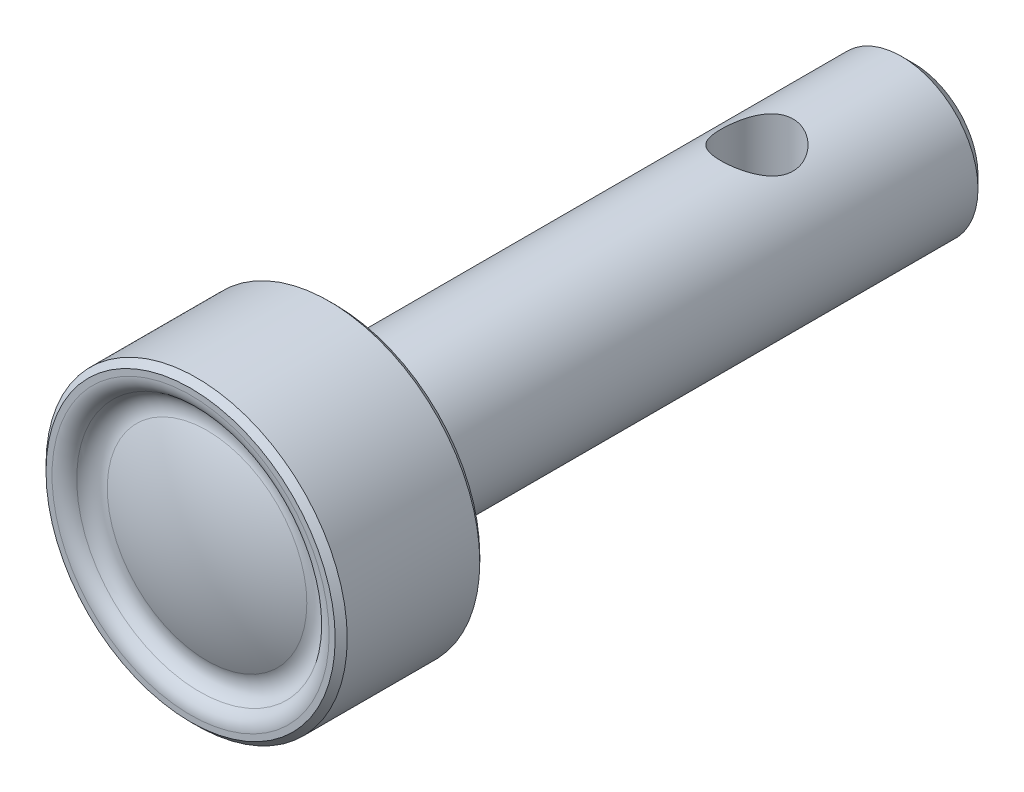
SolidWorks part; units mm, degrees
ref_plane "Спереди" through (0, 0, 0) normal (0, 0, 1) x (1, 0, 0)
ref_plane "Сверху" through (0, 0, 0) normal (0, 1, 0) x (1, 0, 0)
ref_plane "Справа" through (0, 0, 0) normal (1, 0, 0) x (0, 0, -1)
sketch "Эскиз1" plane through (0, 0, 0) normal (1, 0, 0) x (0, 0, -1)
  line L0 (0, 0) -> (0, 5.35)
  line L1 (0, 5.35) -> (-1, 6.35)
  line L2 (-1, 6.35) -> (-48, 6.35)
  line L3 (-48, 6.35) -> (-48, 12)
  line L4 (-60, 12) -> (-59.5, 12.5)
  line L5 (-48.5, 12.5) -> (-59.5, 12.5)
  line L6 (-48, 12) -> (-48.5, 12.5)
  line L7 (-60, 12) -> (-60, 11.5)
  line L8 (-88.0978, 0) -> (30.2304, 0) construction
  line L9 (-64.314, 11.5) -> (-53.3374, 11.5) construction
  line L10 (-60.4295, 0) -> (0, 0)
  arc A0 (-58.6346, 8.2809) -> (-59.25, 10.201) centre (-60, 8.9019) ccw
  arc A2 (-60, 11.5) -> (-59.25, 10.201) centre (-58.5, 11.5) ccw
  arc A3 (-58.6346, 8.2809) -> (-60.4295, 0) centre (-40.4295, 0) ccw
  dimension "D11" = 20
  dimension "D12" = 1.5
  dimension "D13" = 6.35
  dimension "D2" = 45
  dimension "D3" = 1
  dimension "D4" = 60
  dimension "D5" = 12.5
  dimension "D6" = 45
  dimension "D7" = 0.5
  dimension "D8" = 45
  dimension "D9" = 12
  dimension "D10" = 1
revolve "Повернуть1" add sketch "Эскиз1" angle 360 about L10
sketch "Эскиз2" plane through (0, 0, 0) normal (0, 1, 0) x (1, 0, 0)
  line L0 (12, -48) -> (-12, -48) construction
  circle A0 centre (0, -13) radius 3
  dimension "D1" = 6
  dimension "D2" = 35
extrude "Вырез-Вытянуть1" cut sketch "Эскиз2" against normal mid plane 20
